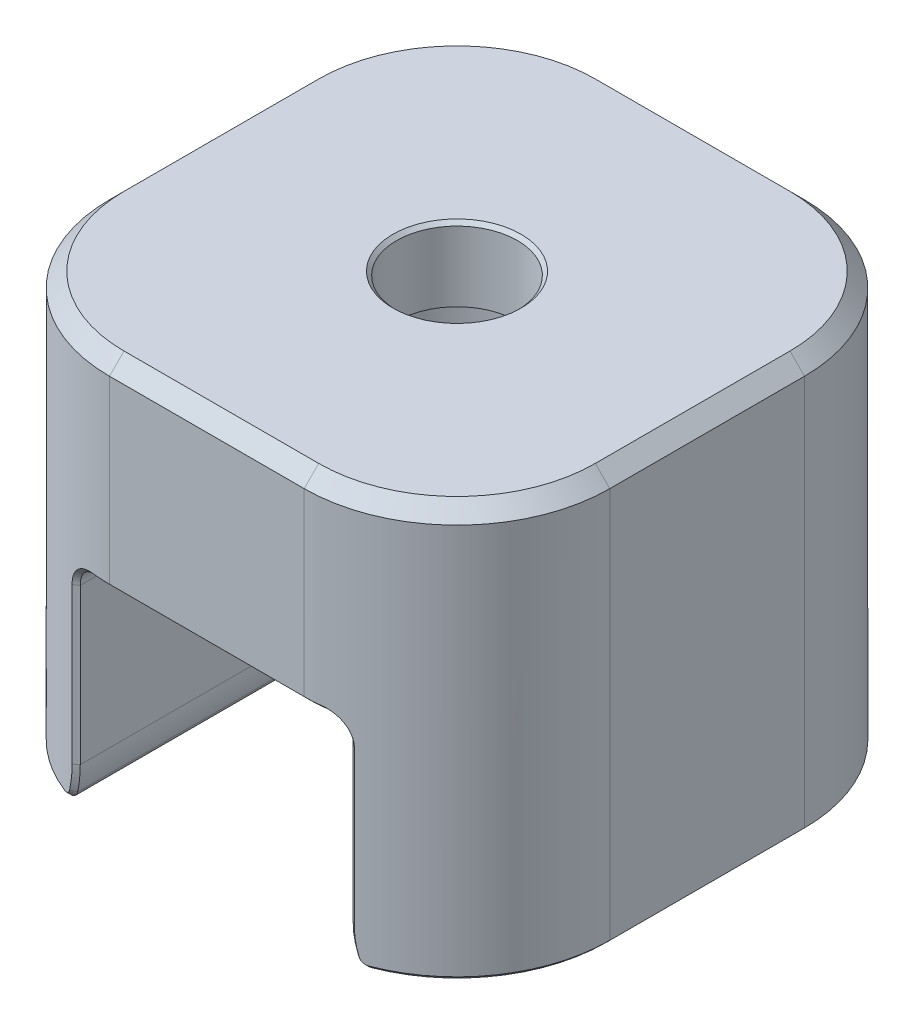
SolidWorks part; units mm, degrees
ref_plane "Front Plane" through (0, 0, 0) normal (0, 0, 1) x (1, 0, 0)
ref_plane "Top Plane" through (0, 0, 0) normal (0, 1, 0) x (1, 0, 0)
ref_plane "Right Plane" through (0, 0, 0) normal (1, 0, 0) x (0, 0, -1)
sketch "Sketch1" plane through (0, 0, 0) normal (0, 1, 0) x (1, 0, 0)
  line L5 (6.7945, -17.4625) -> (-6.7945, -17.4625)
  line L6 (17.4625, -6.7945) -> (17.4625, 6.7945)
  line L7 (6.7945, 17.4625) -> (-6.7945, 17.4625)
  line L8 (-17.4625, -6.7945) -> (-17.4625, 6.7945)
  line L9 (17.4625, -17.4625) -> (-17.4625, 17.4625) construction
  line L10 (17.4625, 17.4625) -> (-17.4625, -17.4625) construction
  arc A0 (6.7945, 17.4625) -> (17.4625, 6.7945) centre (6.7945, 6.7945) cw
  arc A1 (17.4625, -6.7945) -> (6.7945, -17.4625) centre (6.7945, -6.7945) cw
  arc A2 (-6.7945, -17.4625) -> (-17.4625, -6.7945) centre (-6.7945, -6.7945) cw
  arc A3 (-17.4625, 6.7945) -> (-6.7945, 17.4625) centre (-6.7945, 6.7945) cw
  point P0 (0, 0)
  dimension "D3" = 10.668
  dimension "D1" = 34.925
  dimension "D2" = 34.925
extrude "Boss-Extrude1" add sketch "Sketch1" along normal blind 28.575
sketch "Sketch2" plane through (0, 0, 0) normal (0, 0, 1) x (1, 0, 0)
  line L0 (-17.4625, 0) -> (-6.7945, 0) construction
  line L2 (-9.525, 2.3622) -> (-9.525, 13.208)
  line L3 (-8.001, 14.732) -> (8.001, 14.732)
  line L4 (9.525, 2.3622) -> (9.525, 13.208)
  line L5 (0, 14.732) -> (0, 0) construction
  line L6 (6.7945, 0) -> (17.4625, 0) construction
  line L7 (8.4326, 0) -> (10.521, 0)
  line L8 (8.4326, 0) -> (8.4326, -2.3255)
  line L9 (8.4326, -2.3255) -> (-8.4326, -2.3255)
  line L10 (-8.4326, -2.3255) -> (-8.4326, 0)
  line L11 (-8.4326, 0) -> (-10.521, 0)
  arc A0 (9.525, 13.208) -> (8.001, 14.732) centre (8.001, 13.208) ccw
  arc A1 (-9.525, 13.208) -> (-8.001, 14.732) centre (-8.001, 13.208) cw
  arc A2 (9.525, 2.3622) -> (9.7909, 0.5438) centre (15.875, 2.3622) ccw
  arc A3 (9.7909, 0.5438) -> (10.521, 0) centre (10.521, 0.762) ccw
  arc A4 (-9.7909, 0.5438) -> (-10.521, 0) centre (-10.521, 0.762) cw
  arc A5 (-9.525, 2.3622) -> (-9.7909, 0.5438) centre (-15.875, 2.3622) cw
  point P12 (9.525, 14.732)
  point P15 (-9.525, 14.732)
  dimension "D3" = 1.524
  dimension "D4" = 6.35
  dimension "D6" = 0.762
  dimension "D1" = 19.05
  dimension "D2" = 14.732
  dimension "D5" = 2.3622
extrude "Cut-Extrude1" cut sketch "Sketch2" against normal mid plane 34.925
chamfer "Chamfer1" distance 1.016 angle 45 8 edges at (17.4625, 28.575, 0) (14.3379, 28.575, 14.3379) (0, 28.575, 17.4625) (-14.3379, 28.575, 14.3379) (-17.4625, 28.575, 0) (-14.3379, 28.575, -14.3379) (0, 28.575, -17.4625) (14.3379, 28.575, -14.3379)
chamfer "Chamfer2" distance 0.254 angle 45 28 edges at (17.4625, 0, 0) (15.5569, 0, -12.8794) (15.5569, 0, 12.8794) (10.025, 0.1835, -16.9616) (10.0759, 0.1436, 16.9453) (9.525, 7.7851, -17.1071) (9.525, 7.7851, 17.1071) (9.2071, 14.1396, -17.1861) (8.9566, 14.3952, 17.2411) (0, 14.732, -17.4625) (0, 14.732, 17.4625) (-8.9566, 14.3952, -17.2411) (-9.2071, 14.1396, 17.1861) (-9.525, 7.7851, -17.1071) (-9.525, 7.7851, 17.1071) (-10.0759, 0.1436, -16.9453) (-10.025, 0.1835, 16.9616) (-15.5569, 0, -12.8794) (-15.5569, 0, 12.8794) (-17.4625, 0, 0) (7.3987, 14.732, -17.4454) (7.3987, 14.732, 17.4454) (-7.3987, 14.732, -17.4454) (-7.3987, 14.732, 17.4454)
hole_wizard "CBORE for 5/16 Socket Head Cap Screw1" positions "Sketch3" profile "Sketch4" counterbore size "5/16" standard "ANSI Inch"
sketch "Sketch3" plane through (0, 14.732, 0) normal (0, -1, 0) x (-1, 0, 0)
  point P0 (0, 0)
sketch "Sketch4" plane through (0, 14.732, 0) normal (1, 0, 0) x (0, 0, -1)
  line L0 (0, 0) -> (0, 13.843)
  line L1 (0, 13.843) -> (4.1783, 13.843)
  line L3 (4.1783, 13.843) -> (4.1783, 8.7122)
  line L4 (4.1783, 8.7122) -> (6.35, 8.7122)
  line L5 (6.35, 8.7122) -> (6.35, 0)
  line L7 (6.35, 0) -> (0, 0)
  line L11 (0, -6.35) -> (0, 107.95) construction
  dimension "Thru Hole Dia." = 8.3566
  dimension "Thru Hole Depth" = 13.843
  dimension "C'Bore Dia." = 12.7
  dimension "C'Bore Depth" = 8.7122
hole_wizard "3/8-16 Tapped Hole1" positions "Sketch5" profile "Sketch6" tap size "3/8-16" standard "ANSI Inch"
sketch "Sketch5" plane through (0, 23.4442, 0) normal (0, -1, 0) x (-1, 0, 0)
  point P0 (0, 0)
sketch "Sketch6" plane through (0, 23.4442, 0) normal (1, 0, 0) x (0, 0, -1)
  line L0 (0, 0) -> (0, 5.1308)
  line L1 (0, 5.1308) -> (4.2164, 5.1308)
  line L2 (4.2164, 5.1308) -> (4.2164, 0)
  line L5 (4.2164, 0) -> (0, 0)
  line L11 (0, -6.35) -> (0, 107.95) construction
  dimension "Thru Tap Drill Dia." = 8.4328
  dimension "Thru Tap Drill Depth" = 5.1308
chamfer "Chamfer3" distance 0.254 angle 45 1 edges at (0, 14.732, -6.35)
chamfer "Chamfer4" distance 0.254 angle 45 1 edges at (0, 28.575, -4.2164)
